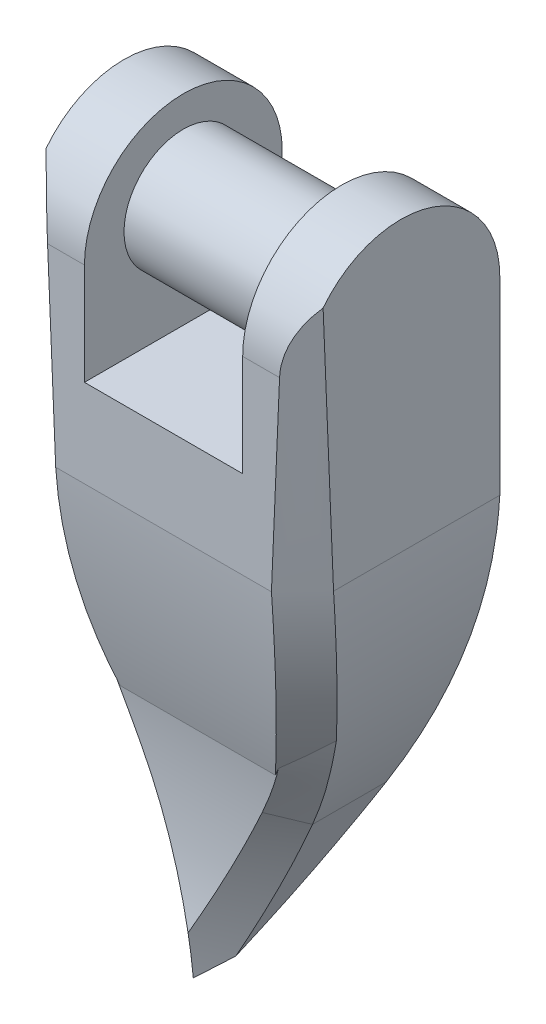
SolidWorks part; units mm, degrees
ref_plane "Front Plane" through (0, 0, 0) normal (0, 0, 1) x (1, 0, 0)
ref_plane "Top Plane" through (0, 0, 0) normal (0, 1, 0) x (1, 0, 0)
ref_plane "Right Plane" through (0, 0, 0) normal (1, 0, 0) x (0, 0, -1)
sketch "Sketch1" plane through (0, 0, 0) normal (0, 0, 1) x (1, 0, 0)
  line L0 (-45.2068, 16.3695) -> (-42.2068, 16.3695)
  line L1 (-56.2068, 16.3695) -> (-56.2068, 1.7899)
  line L3 (-42.2068, 1.7899) -> (-42.2068, 16.3695)
  line L5 (-56.2068, 16.3695) -> (-53.2068, 16.3695)
  line L6 (-53.2068, 8.2323) -> (-45.2068, 8.2323)
  line L7 (-53.2068, 8.2323) -> (-53.2068, 16.3695)
  line L8 (-53.556, -10.5396) -> (-49.2068, -20.1871)
  line L9 (-45.2068, 8.2323) -> (-45.2068, 16.3695)
  line L10 (-49.2068, -20.1871) -> (-44.8575, -10.5396)
  arc A0 (-44.8575, -10.5396) -> (-42.2068, 1.7899) centre (-72.2068, 1.7899) ccw
  arc A1 (-53.556, -10.5396) -> (-56.2068, 1.7899) centre (-26.2068, 1.7899) cw
  dimension "D1" = 30
  dimension "D2" = 30
extrude "Boss-Extrude1" add sketch "Sketch1" along normal blind 10
sketch "Sketch2" plane through (0, 8.2323, 0) normal (0, 1, 0) x (1, 0, 0)
  line L1 (-53.2068, 0) -> (-45.2068, 0)
  line L2 (-53.2068, 0) -> (-53.2068, -10)
  line L3 (-53.2068, -10) -> (-45.2068, -10)
  line L4 (-45.2068, 0) -> (-45.2068, -10)
extrude "Cut-Extrude1" cut sketch "Sketch2" against normal blind 2
sketch "Sketch3" plane through (-45.2068, 0, 0) normal (-1, 0, 0) x (0, 0, 1)
  circle A0 centre (5, 11.8175) radius 3
extrude "Boss-Extrude2" add sketch "Sketch3" along normal blind 8
sketch "Sketch4" plane through (-56.2068, 0, 0) normal (-1, 0, 0) x (0, 0, 1)
  line L1 (0, 11.3695) -> (0, 16.3695)
  line L2 (0, 16.3695) -> (10, 16.3695)
  line L3 (10, 16.3695) -> (10, 11.3695)
  circle A1 centre (5, 11.3695) radius 5
extrude "Cut-Extrude2" cut sketch "Sketch4" against normal blind 24 contours A1 L2 M1 | A1 M3 M4
sketch "Sketch5" plane through (-56.2068, 0, 0) normal (-1, 0, 0) x (0, 0, 1)
  line L0 (10, -20.1871) -> (0, -20.1871)
  line L1 (0, -20.1871) -> (0, 1.7899)
  spline S0 degree 2 poles (0, 1.7899) (0.7484, -10.9447) (10, -20.1871) knots 0 0 0 1 1 1
extrude "Cut-Extrude3" cut sketch "Sketch5" against normal blind 24
sketch "Sketch6" plane through (-56.2068, 0, 0) normal (-1, 0, 0) x (0, 0, 1)
  line L0 (10, -10.5396) -> (10, -20.1871) construction
  line L1 (10, 1.7899) -> (10, -20.1871)
  parabola Q0 construction
  spline S0 degree 2 poles (10, 1.7899) (9.6728, -3.1424) (8.2668, -7.8772) knots 0 0 0 1 1 1
  spline S1 degree 2 poles (8.2668, -7.8772) (7.4718, -14.2314) (10, -20.1871) knots 0 0 0 1 1 1
extrude "Cut-Extrude4" cut sketch "Sketch6" against normal blind 24
chamfer "Chamfer1" distance 1.5 angle 45 6 edges at (-55.7815, -3.2432, 9.3759) (-42.3079, -0.6717, 9.768) (-46.7552, -14.749, 8.398) (-51.0713, -16.0511, 8.6558)
